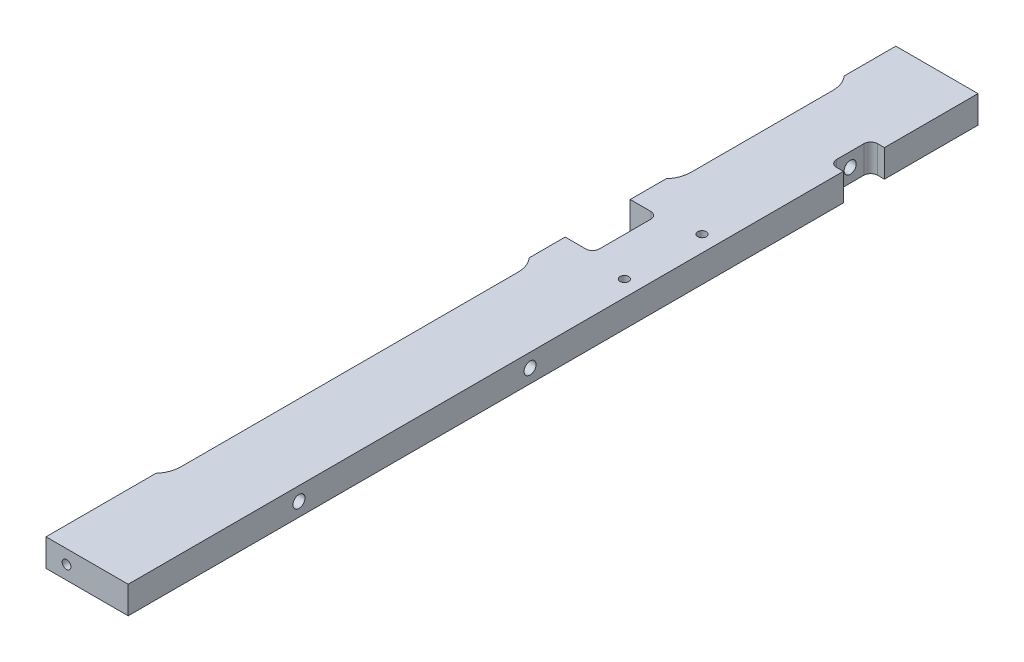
SolidWorks part; units mm, degrees
ref_plane "Front Plane" through (0, 0, 0) normal (0, 0, 1) x (1, 0, 0)
ref_plane "Top Plane" through (0, 0, 0) normal (0, 1, 0) x (1, 0, 0)
ref_plane "Right Plane" through (0, 0, 0) normal (1, 0, 0) x (0, 0, -1)
sketch "Sketch1" plane through (0, 0, 0) normal (0, 1, 0) x (1, 0, 0)
  line L0 (0, 197.7453) -> (0, -197.7453)
  line L1 (0, -197.7453) -> (-38.1, -197.7453)
  line L8 (-38.1, -197.7453) -> (-38.1, 197.7453)
  line L9 (-38.1, 197.7453) -> (0, 197.7453)
  dimension "D2" = 395.4907
  dimension "D5" = 38.1
extrude "Boss-Extrude1" add sketch "Sketch1" along normal mid plane 12.7
sketch "Sketch7" plane through (0, 6.35, 0) normal (0, 1, 0) x (1, 0, 0)
  line L0 (0, -197.7453) -> (0, 197.7453) construction
  line L1 (0, 185.0453) -> (-9.525, 185.0453)
  line L2 (0, 185.0453) -> (0, 108.8453)
  line L3 (0, 108.8453) -> (-9.525, 108.8453)
  line L4 (-9.525, 185.0453) -> (-9.525, 108.8453)
  line L5 (0, 197.7453) -> (-38.1, 197.7453) construction
  dimension "D1" = 12.7
  dimension "D2" = 9.525
  dimension "D3" = 76.2
extrude "Cut-Extrude1" [suppressed] cut sketch "Sketch7" against normal blind 15.875
chamfer "Chamfer1" [suppressed] distance 3.175 angle 45
chamfer "Chamfer2" [suppressed] distance 28.575 angle 45
fillet "Fillet1" [suppressed] radius 9.525
hole_wizard "#10-32 Tapped Hole2" positions "Sketch9" profile "Sketch8" tap size "#10-32" standard "ANSI Inch"
sketch "Sketch9" plane through (0, 6.35, 0) normal (0, 1, 0) x (1, 0, 0)
  circle A0 centre (-7.5, 75.8422) radius 3.25 construction
  circle A1 centre (-7.5, 39.8421) radius 3.25 construction
  point P0 (-7.5, 75.8421)
  point P7 (-7.5, 39.8421)
sketch "Sketch8" plane through (-7.5, 6.35, -75.8421) normal (1, 0, 0) x (0, 0, 1)
  line L0 (0, 0) -> (0, 12.7)
  line L1 (0, 12.7) -> (2.0193, 12.7)
  line L2 (2.0193, 12.7) -> (2.0193, 0)
  line L5 (2.0193, 0) -> (0, 0)
  line L11 (0, -6.35) -> (0, 107.95) construction
  dimension "Thru Tap Drill Dia." = 4.0386
  dimension "Thru Tap Drill Depth" = 12.7
sketch "Sketch11" plane through (0, 6.35, 0) normal (0, 1, 0) x (1, 0, 0)
  line L0 (-38.1, 197.7453) -> (-38.1, -197.7453) construction
  line L1 (0, 197.7453) -> (-38.1, 197.7453) construction
  line L2 (-38.1, 172.3453) -> (-38.1, 89.7953)
  line L4 (-34.925, 163.9451) -> (-34.925, 98.1956)
  line L6 (-38.1, 26.2953) -> (-38.1, -146.7421)
  line L8 (-34.925, 17.8951) -> (-34.925, -138.3419)
  arc A0 (-34.925, 98.1956) -> (-38.1, 89.7953) centre (-47.625, 98.1956) cw
  arc A1 (-34.925, 17.8951) -> (-38.1, 26.2953) centre (-47.625, 17.8951) ccw
  arc A2 (-34.925, -138.3419) -> (-38.1, -146.7421) centre (-47.625, -138.3419) cw
  arc A3 (-34.925, 163.9451) -> (-38.1, 172.3453) centre (-47.625, 163.9451) ccw
  dimension "D1" = 12.7
  dimension "D2" = 344.4875
  dimension "D6" = 107.95
  dimension "D3" = 63.5
  dimension "D4" = 25.4
  dimension "D5" = 3.175
extrude "Cut-Extrude2" cut sketch "Sketch11" against normal through all
chamfer "Chamfer3" [suppressed] distance 6.35 angle 45
hole_wizard "#10-32 Tapped Hole1" positions "Sketch13" profile "Sketch12" tap size "#10-32" standard "ANSI Inch"
sketch "Sketch13" plane through (0, 0, 200.8187) normal (0, 0, 1) x (1, 0, 0)
  line L0 (0, 0) -> (-19.05, 0) construction
  line L1 (0, 6.35) -> (0, -6.35) construction
  point P0 (-19.05, 0)
  dimension "D1" = 19.05
sketch "Sketch12" plane through (-19.05, 0, 200.8187) normal (1, 0, 0) x (0, -1, 0)
  line L0 (0, 0) -> (0, 17.1645)
  line L1 (0, 17.1645) -> (2.0193, 15.9512)
  line L2 (2.0193, 15.9512) -> (2.0193, 0)
  line L5 (2.0193, 0) -> (0, 0)
  line L10 (0, 17.1645) -> (-2.0193, 15.9512) construction
  line L11 (0, -6.35) -> (0, 107.95) construction
  dimension "Tap Drill Dia." = 4.0386
  dimension "Tap Drill Depth" = 15.9512
  dimension "Drill Angle" = 118
hole_wizard "CBORE for #10 Socket Head Cap Screw1" positions "Sketch15" profile "Sketch14" counterbore size "#10" standard "ANSI Inch"
sketch "Sketch15" plane through (-34.925, 0, 0) normal (-1, 0, 0) x (0, 0, 1)
  line L0 (118.5704, 0) -> (11.4014, 0) construction
  line L1 (11.4014, 0) -> (-143.3671, 0) construction
  line L8 (-197.7453, 6.35) -> (-197.7453, -6.35) construction
  point P0 (118.5704, 0)
  point P1 (11.4014, 0)
  point P3 (-143.3671, 0)
  dimension "D1" = 107.1691
  dimension "D2" = 54.3783
  dimension "D3" = 154.7684
sketch "Sketch14" plane through (-34.925, 0, 118.5704) normal (0, 1, 0) x (0, 0, 1)
  line L0 (0, 0) -> (0, 34.925)
  line L1 (0, 34.925) -> (2.8067, 34.925)
  line L3 (2.8067, 34.925) -> (2.8067, 24.638)
  line L4 (2.8067, 24.638) -> (4.7625, 24.638)
  line L5 (4.7625, 24.638) -> (4.7625, 0)
  line L7 (4.7625, 0) -> (0, 0)
  line L11 (0, -6.35) -> (0, 107.95) construction
  dimension "Thru Hole Dia." = 5.6134
  dimension "Thru Hole Depth" = 34.925
  dimension "C'Bore Dia." = 9.525
  dimension "C'Bore Depth" = 24.638
sketch "Sketch16" plane through (0, 6.35, 0) normal (0, 1, 0) x (1, 0, 0)
  line L0 (0, -197.7453) -> (0, 197.7453) construction
  line L1 (-38.1, 197.7453) -> (0, 197.7453)
  line L2 (-38.1, 197.7453) -> (-38.1, 196.2721)
  line L3 (-38.1, 196.2721) -> (0, 196.2721)
  line L4 (0, 197.7453) -> (0, 196.2721)
  dimension "D1" = 1.4732
extrude "Cut-Extrude3" cut sketch "Sketch16" against normal through all
sketch "Sketch17" plane through (0, 6.35, 0) normal (0, 1, 0) x (1, 0, 0)
  line L0 (-38.1, 89.7953) -> (-38.1, 26.2953) construction
  line L1 (-38.1, 42.9641) -> (-25.4, 42.9641)
  line L2 (-38.1, 42.9641) -> (-38.1, 73.1266)
  line L3 (-38.1, 73.1266) -> (-25.4, 73.1266)
  line L4 (-25.4, 42.9641) -> (-25.4, 73.1266)
  point P6 (-38.1, 58.0453)
  dimension "D1" = 30.1625
  dimension "D2" = 12.7
extrude "Cut-Extrude4" cut sketch "Sketch17" against normal through all
sketch "Sketch18" [suppressed] plane through (0, 0, -197.4406) normal (0, 0, -1) x (-1, 0, 0)
  line L1 (34.925, 6.35) -> (0, 6.35)
  line L2 (34.925, 6.35) -> (34.925, -6.35)
  line L3 (34.925, -6.35) -> (0, -6.35)
  line L4 (0, 6.35) -> (0, -6.35)
extrude "Boss-Extrude2" [suppressed] add sketch "Sketch18" along normal blind 3.175
sketch "Sketch20" [suppressed] plane through (0, 6.35, 0) normal (0, 1, 0) x (1, 0, 0)
  line L0 (-28.575, -197.6438) -> (-25.4, -200.8188)
  line L1 (-25.4, -200.8188) -> (0, -200.8188)
  line L2 (0, -200.8188) -> (0, -197.6438)
  line L3 (0, -197.6438) -> (-28.575, -197.6438)
  line L4 (-34.925, -191.2937) -> (-28.575, -197.6438) construction
  dimension "D1" = 3.175
extrude "Boss-Extrude3" [suppressed] add sketch "Sketch20" against normal up to surface (12.7 mm away)
sketch "Sketch21" plane through (0, -6.35, 0) normal (0, -1, 0) x (1, 0, 0)
  line L0 (0, 197.7453) -> (0, -196.2721) construction
  line L1 (0, 197.7453) -> (-22.225, 197.7453)
  line L2 (0, 197.7453) -> (0, 188.2203)
  line L3 (0, 188.2203) -> (-22.225, 188.2203)
  line L4 (-22.225, 197.7453) -> (-22.225, 188.2203)
  dimension "D1" = 9.525
  dimension "D2" = 22.225
extrude "Cut-Extrude5" [suppressed] cut sketch "Sketch21" against normal through all
fillet "Fillet3" [suppressed] radius 3.175
sketch "Sketch22" plane through (0, 6.35, 0) normal (1, 0, 0) x (0, -1, 0)
  line L0 (0, -197.7453) -> (0, 196.2721) construction
  line L1 (12.7, 152.8921) -> (0, 152.8921)
  line L2 (12.7, 152.8921) -> (12.7, 133.8421)
  line L3 (12.7, 133.8421) -> (0, 133.8421)
  line L4 (0, 152.8921) -> (0, 133.8421)
  line L5 (12.7, -197.7453) -> (12.7, 196.2721) construction
  line L6 (6.35, 143.3671) -> (0, 143.3671) construction
  dimension "D1" = 19.05
extrude "Cut-Extrude6" cut sketch "Sketch22" against normal blind 6.35
hole_wizard "#10-32 Tapped Hole3" positions "Sketch24" profile "Sketch23" tap size "#10-32" standard "ANSI Inch"
sketch "Sketch24" plane through (0, 0, 197.7453) normal (0, 0, 1) x (1, 0, 0)
  line L0 (0, 0) -> (-28.575, 0) construction
  line L1 (0, 6.35) -> (0, -6.35) construction
  line L3 (-38.1, 6.35) -> (-38.1, -6.35) construction
  point P0 (-28.575, 0)
  dimension "D1" = 9.525
sketch "Sketch23" plane through (-28.575, 0, 197.7453) normal (1, 0, 0) x (0, -1, 0)
  line L0 (0, 0) -> (0, 26.6895)
  line L1 (0, 26.6895) -> (2.0193, 25.4762)
  line L2 (2.0193, 25.4762) -> (2.0193, 0)
  line L5 (2.0193, 0) -> (0, 0)
  line L10 (0, 26.6895) -> (-2.0193, 25.4762) construction
  line L11 (0, -6.35) -> (0, 107.95) construction
  dimension "Tap Drill Dia." = 4.0386
  dimension "Tap Drill Depth" = 25.4762
  dimension "Drill Angle" = 118
fillet "Fillet2" radius 3.175 4 edges at (-25.4, 0, -73.1266) (-25.4, 0, -42.9641) (-6.35, 0, -152.8921) (-6.35, 0, -133.8421)
